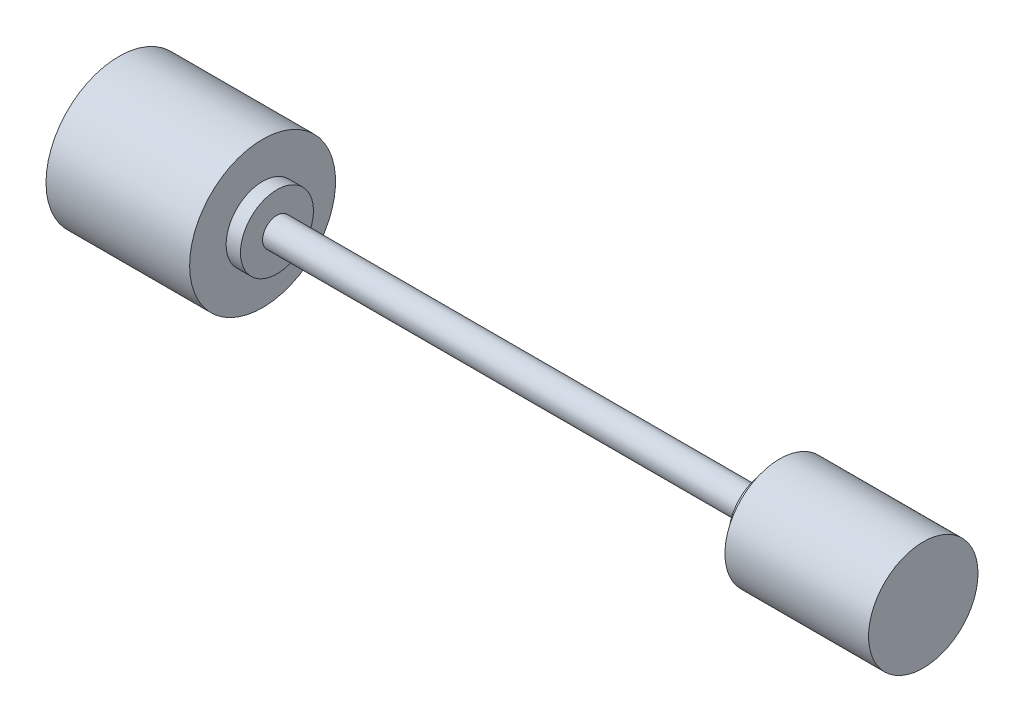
SolidWorks part; units mm, degrees
ref_plane "Front Plane" through (0, 0, 0) normal (0, 0, 1) x (1, 0, 0)
ref_plane "Top Plane" through (0, 0, 0) normal (0, 1, 0) x (1, 0, 0)
ref_plane "Right Plane" through (0, 0, 0) normal (1, 0, 0) x (0, 0, -1)
sketch "Sketch1" plane through (0, 0, 0) normal (1, 0, 0) x (0, 0, -1)
  circle A0 centre (0, 0) radius 10
extrude "Extrude1" add sketch "Sketch1" along normal blind 340
sketch "Sketch2" plane through (340, 0, 0) normal (1, 0, 0) x (0, 0, -1)
  circle A0 centre (0, 0) radius 25.4
extrude "Extrude2" add sketch "Sketch2" along normal blind 10
sketch "Sketch3" plane through (350, 0, 0) normal (1, 0, 0) x (0, 0, -1)
  circle A0 centre (0, 0) radius 38.1
extrude "Extrude3" add sketch "Sketch3" along normal blind 100
sketch "Sketch4" plane through (0, 0, 0) normal (-1, 0, 0) x (0, 0, 1)
  circle A0 centre (0, 0) radius 25.4
extrude "Extrude4" add sketch "Sketch4" along normal blind 10
sketch "Sketch5" plane through (-10, 0, 0) normal (-1, 0, 0) x (0, 0, 1)
  circle A0 centre (0, 0) radius 50.8
extrude "Extrude5" add sketch "Sketch5" along normal blind 100
